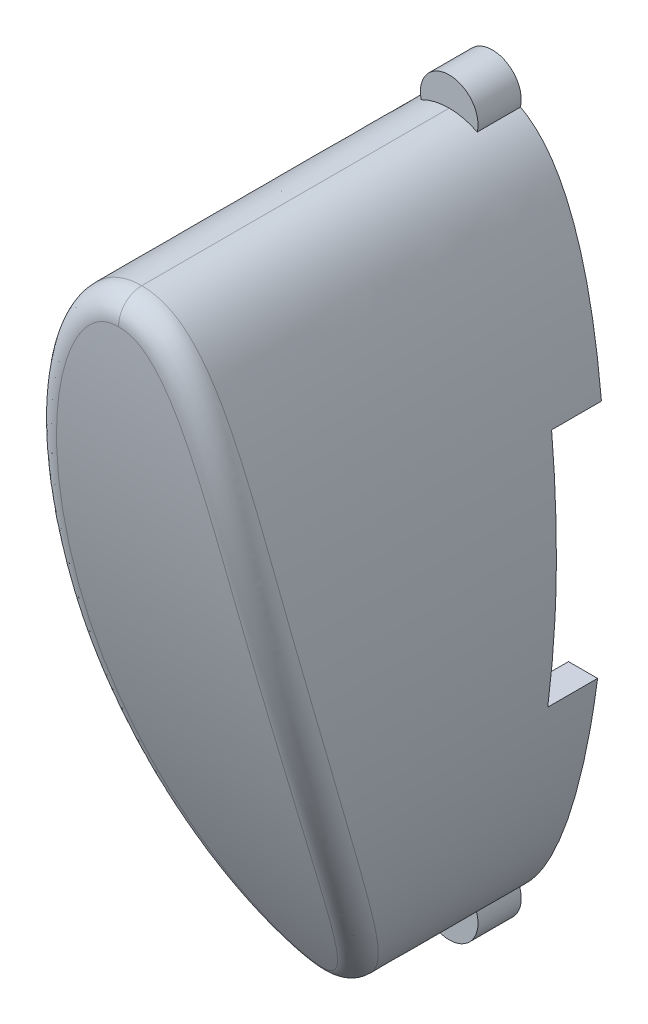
SolidWorks part; units mm, degrees
ref_plane "Plan de face" through (0, 0, 0) normal (0, 0, 1) x (1, 0, 0)
ref_plane "Plan de dessus" through (0, 0, 0) normal (0, 1, 0) x (1, 0, 0)
ref_plane "Plan de droite" through (0, 0, 0) normal (1, 0, 0) x (0, 0, -1)
sketch "Esquisse1" plane through (0, 0, 0) normal (0, 0, 1) x (1, 0, 0)
  line L0 (0, 0) -> (0, -22.5015) construction
  line L2 (0.9939, 1.4985) -> (-0.9939, 1.4985) construction
  line L3 (-0.894, -22.5015) -> (0.894, -22.5015) construction
  line L4 (-3.95, -18.145) -> (-3.95, -22.5658) construction
  spline S0 degree 3 poles (0, -22.5015) (-2.5672, -22.5015) (-3.95, -15.3599) (-3.95, -5.0112) (-3.1577, 1.4985) (0, 1.4985) knots 0 0 0 0 0.519433 0.519433 1 1 1 1
  spline S1 degree 3 poles (0, -22.5015) (2.5672, -22.5015) (3.95, -15.3599) (3.95, -5.0112) (3.1577, 1.4985) (0, 1.4985) knots 0 0 0 0 0.519433 0.519433 1 1 1 1
  dimension "D1" = 24
  dimension "D2" = 7.9
extrude "Extrusion1" add sketch "Esquisse1" along normal blind 13
sketch "Esquisse2" plane through (0, 0, 0) normal (1, 0, 0) x (0, 0, -1)
  line L0 (0, -6.1658) -> (0, -14.5658)
  line L1 (0, -6.1658) -> (-1.73, -6.1658)
  line L2 (0, -14.5658) -> (-1.73, -14.5658)
  line L3 (-1.73, -6.1658) -> (-1.73, -14.5658)
  line L4 (0, -22.5015) -> (0, 1.4985) construction
  line L5 (-13, -22.5015) -> (0, -22.5015) construction
  line L6 (-13, 1.4985) -> (-17.3217, 1.4985)
  line L7 (-17.3217, 1.4985) -> (-17.3217, -25.4374)
  line L8 (-17.3217, -25.4374) -> (-5.679, -25.4374)
  line L9 (-5.679, -25.4374) -> (-5.679, -22.5015)
  spline S0 degree 3 poles (-5.679, -22.5015) (-8.9754, -17.1625) (-12.7865, -7.4503) (-13, 1.4985) knots 0 0 0 0 1 1 1 1
  dimension "D1" = 8.4
  dimension "D2" = 1.73
extrude "Enlèv. mat.-Extru.1" cut sketch "Esquisse2" against normal through all and the other way through all
fillet "Congé1" radius 0.8 2 edges at (-3.9124, -11.5628, 10.5913) (3.3413, -16.4969, 8.7413)
shell "Coque1" thickness 1
sketch "Esquisse3" plane through (0, 0, 1.73) normal (0, 0, -1) x (-1, 0, 0)
  line L0 (0.5, -10.4223) -> (0.5, -12.4223)
  line L1 (-0.5, -7.4223) -> (0.5, -7.4223)
  line L2 (-0.5, -7.4223) -> (-0.5, -9.4223)
  line L3 (-0.5, -12.4223) -> (0.5, -12.4223)
  line L4 (0.5, -7.4223) -> (0.5, -9.4223)
  line L5 (-2.5, -9.4223) -> (-0.5, -9.4223)
  line L6 (2.5, -9.4223) -> (2.5, -10.4223)
  line L7 (-2.5, -10.4223) -> (-0.5, -10.4223)
  line L8 (-2.5, -9.4223) -> (-2.5, -10.4223)
  line L9 (0.5, -9.4223) -> (2.5, -9.4223)
  line L10 (-0.5, -10.4223) -> (-0.5, -12.4223)
  line L11 (0.5, -10.4223) -> (2.5, -10.4223)
  line L12 (0, 0) -> (0, -21.5015) construction
  dimension "D1" = 1
  dimension "D2" = 2
  dimension "D3" = 0.5
extrude "Extrusion4" add sketch "Esquisse3" against normal up to surface (9.0028 mm away)
sketch "Esquisse4" plane through (0, 0, 0) normal (0, 0, -1) x (-1, 0, 0)
  circle A0 centre (0, 1.4985) radius 1
  circle A1 centre (0, -22.5015) radius 1
extrude "Extrusion5" add sketch "Esquisse4" against normal blind 1.5
